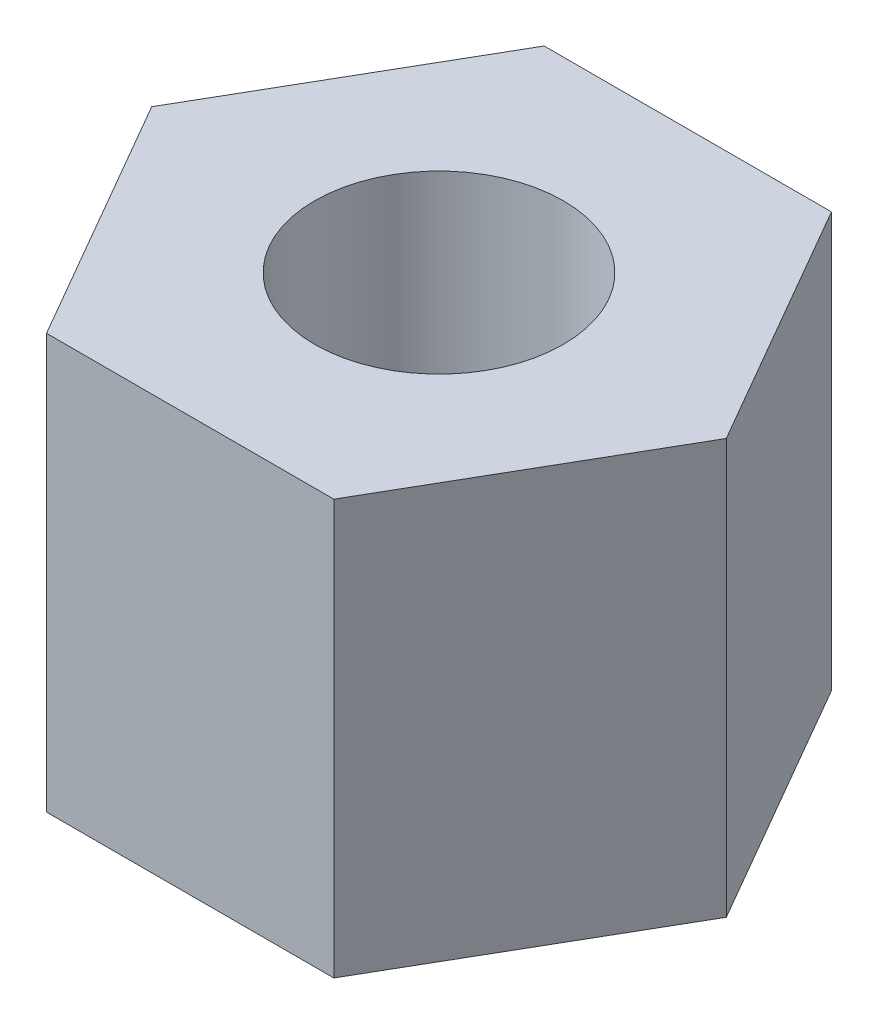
SolidWorks part; units mm, degrees
ref_plane "Front" through (0, 0, 0) normal (0, 0, 1) x (1, 0, 0)
ref_plane "Top" through (0, 0, 0) normal (0, 1, 0) x (1, 0, 0)
ref_plane "Right" through (0, 0, 0) normal (1, 0, 0) x (0, 0, -1)
sketch "草图1" plane through (0, 0, 0) normal (0, 1, 0) x (1, 0, 0)
  line L1 (3.4641, 0) -> (1.7321, 3)
  line L2 (1.7321, 3) -> (-1.7321, 3)
  line L3 (-1.7321, 3) -> (-3.4641, 0)
  line L4 (-3.4641, 0) -> (-1.7321, -3)
  line L5 (-1.7321, -3) -> (1.7321, -3)
  line L6 (1.7321, -3) -> (3.4641, 0)
  circle A0 centre (0, 0) radius 3 construction
  circle A1 centre (0, 0) radius 1.5
  dimension "D1" = 3
  dimension "D2" = 6
extrude "凸台-拉伸1" add sketch "草图1" along normal blind 5
